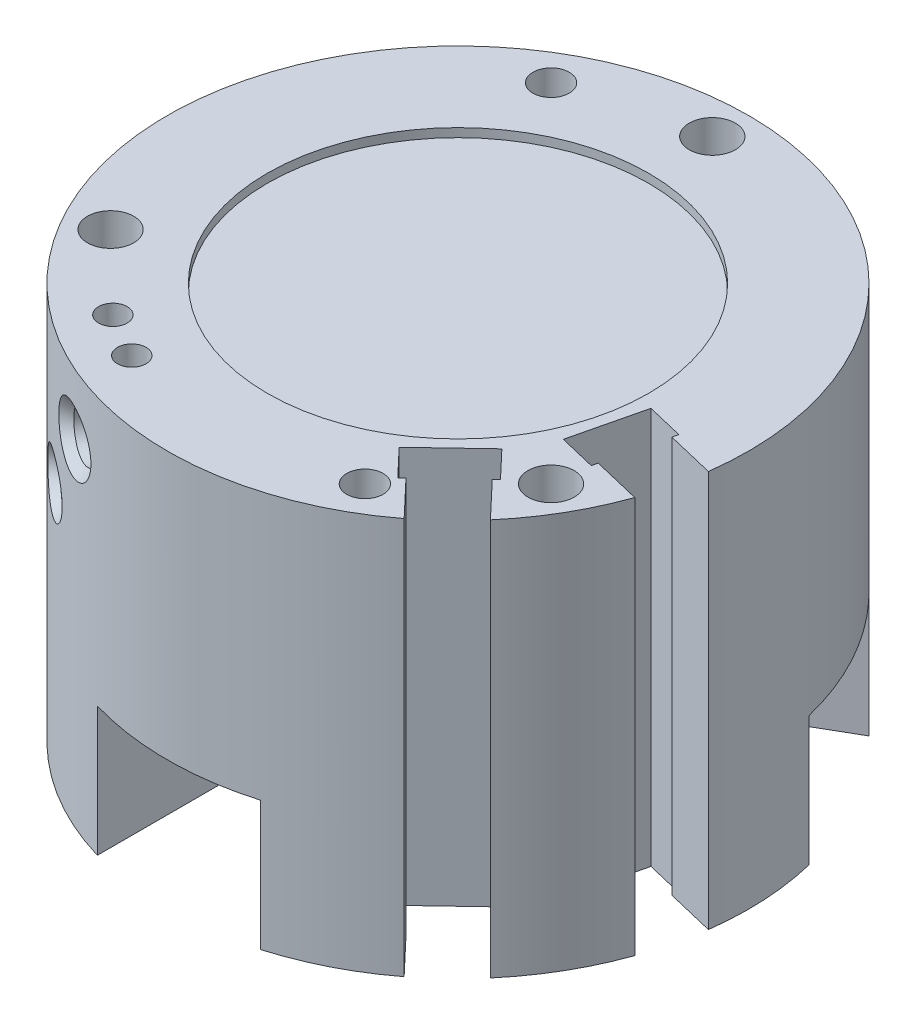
SolidWorks part; units mm, degrees
ref_plane "Front/Back" through (0, 0, 0) normal (0, 0, 1) x (1, 0, 0)
ref_plane "Top/Bottom" through (0, 0, 0) normal (0, 1, 0) x (1, 0, 0)
ref_plane "Right/Left" through (0, 0, 0) normal (1, 0, 0) x (0, 0, -1)
sketch "Sketch1" plane through (0, 0, 0) normal (0, 1, 0) x (1, 0, 0)
  circle A0 centre (0, 0) radius 25.4
  dimension "D1" = 50.8
extrude "Extrude1" add sketch "Sketch1" along normal mid plane 34.671
hole_wizard "#10-32 Tapped Hole1" positions "Sketch3" profile "Sketch2" tap size "#10-32" standard "Ansi Inch"
sketch "Sketch3" plane through (0, 17.3355, 0) normal (0, 1, 0) x (-1, 0, 0)
  line L0 (0, 0) -> (0, -27.1064) construction
  circle A0 centre (0, 0) radius 22.225 construction
  point P0 (0, -22.225)
  dimension "D1" = 44.45
sketch "Sketch2" plane through (0, 17.3355, -22.225) normal (1, 0, 0) x (0, 0, 1)
  line L0 (0, 0) -> (0, 14.8277)
  line L1 (0, 14.8277) -> (2.0193, 13.6144)
  line L2 (2.0193, 13.6144) -> (2.0193, 0)
  line L5 (2.0193, 0) -> (0, 0)
  line L10 (0, 14.8277) -> (-2.0193, 13.6144) construction
  line L11 (0, -6.35) -> (0, 107.95) construction
  dimension "Tap Drill Dia." = 4.0386
  dimension "Tap Drill Depth" = 13.6144
  dimension "Drill Angle" = 118
pattern_circular "CirPattern1" count 3 over 360 about axis through (0, 0, 0) along (0, 1, 0) of "#10-32 Tapped Hole1"
sketch "Sketch4" plane through (0, 17.3355, 0) normal (0, 1, 0) x (-1, 0, 0)
  line L0 (0, 0) -> (0, -26.9204) construction
  line L1 (0, 0) -> (16.0935, -27.8748) construction
  circle A0 centre (11.1125, -19.2474) radius 1.5875
  circle A1 centre (0, 0) radius 22.225 construction
  dimension "D2" = 3.175
  dimension "D3" = 44.45
  dimension "D1" = 30
extrude "Cut-Extrude1" cut sketch "Sketch4" against normal blind 3.175
pattern_circular "CirPattern2" count 2 over 360 about axis through (0, 17.3355, 0) along (0, -1, 0) of "Cut-Extrude1"
hole_wizard "M3x0.5 Tapped Hole1" positions "Sketch6" profile "Sketch5" tap size "M3x0.5" standard "Ansi Metric"
sketch "Sketch6" plane through (0, 17.3355, 0) normal (0, 1, 0) x (-1, 0, 0)
  line L0 (0, 0) -> (0, 27.0134) construction
  line L1 (0, 0) -> (11.3675, 25.5318) construction
  line L2 (0, 0) -> (17.8681, 24.5933) construction
  circle A0 centre (0, 0) radius 21.59 construction
  point P0 (8.7814, 19.7234)
  point P8 (12.6903, 17.4667)
  dimension "D1" = 43.18
  dimension "D2" = 24
  dimension "D3" = 12
sketch "Sketch5" plane through (-8.7814, 17.3355, 19.7234) normal (1, 0, 0) x (0, 0, 1)
  line L0 (0, 0) -> (0, 22.3012)
  line L1 (0, 22.3012) -> (1.25, 21.5501)
  line L2 (1.25, 21.5501) -> (1.25, 0)
  line L5 (1.25, 0) -> (0, 0)
  line L10 (0, 22.3012) -> (-1.25, 21.5501) construction
  line L11 (0, -6.35) -> (0, 107.95) construction
  dimension "Tap Drill Dia." = 2.5
  dimension "Tap Drill Depth" = 21.5501
  dimension "Drill Angle" = 118
sketch "Sketch7" plane through (0, 17.3355, 0) normal (0, 1, 0) x (-1, 0, 0)
  circle A0 centre (0, 0) radius 16.6624
  dimension "D1" = 33.3248
extrude "Cut-Extrude2" cut sketch "Sketch7" against normal blind 0.762
ref_plane "Plane4" through (0, 0, 0) normal (-0.5, 0, 0.866) x (0.866, 0, 0.5)
ref_plane "Plane5" through (-12.7, 0, 21.997) normal (-0.5, 0, 0.866) x (0.866, 0, 0.5)
hole_wizard "#10-32 Tapped Hole4" positions "Sketch13" profile "Sketch12" tap size "#10-32" standard "ANSI Inch"
sketch "Sketch13" plane through (-12.7, 0, 21.997) normal (-0.5, 0, 0.866) x (0.866, 0, 0.5)
  line L0 (25.4, 17.3355) -> (-25.4, 17.3355) construction
  line L1 (16.6624, 17.3355) -> (-16.6624, 17.3355) construction
  line L2 (0, 0) -> (0, 22.8777) construction
  line L3 (0, 17.3355) -> (0, -17.3355) construction
  line L4 (2.2568, -4.2146) -> (2.2568, 17.3355) construction
  line L5 (-2.2568, -4.2146) -> (-2.2568, 17.3355) construction
  point P0 (2.2568, 11.7475)
  point P1 (-2.2568, 5.2705)
  dimension "D1" = 5.588
  dimension "D2" = 12.065
sketch "Sketch12" plane through (-10.7456, 11.7475, 23.1254) normal (0, 1, 0) x (0.866, 0, 0.5)
  line L0 (0, 0) -> (0, 9.2397)
  line L1 (0, 9.2397) -> (2.0193, 8.0264)
  line L2 (2.0193, 8.0264) -> (2.0193, 0)
  line L5 (2.0193, 0) -> (0, 0)
  line L10 (0, 9.2397) -> (-2.0193, 8.0264) construction
  line L11 (0, -6.35) -> (0, 107.95) construction
  dimension "Tap Drill Dia." = 4.0386
  dimension "Tap Drill Depth" = 8.0264
  dimension "Drill Angle" = 118
chamfer "Chamfer1" distance 0.762 angle 45 2 edges at (-12.449, 12.2002, 22.1401) (-16.1804, 5.7309, 19.5795)
sketch "Sketch14" plane through (0, 17.3355, 0) normal (0, 1, 0) x (-1, 0, 0)
  line L0 (11.1125, -19.2474) -> (-11.1125, 19.2474) construction
  line L1 (0, 0) -> (-20.4632, 21.5637) construction
  line L2 (-15.453, 20.1585) -> (-12.4807, 17.0263)
  line L3 (-16.3498, 13.3547) -> (-19.3221, 16.4868)
  line L4 (-12.4807, 17.0263) -> (-12.1122, 17.376)
  line L5 (-9.8392, 14.9808) -> (-14.4454, 10.6098)
  line L6 (-14.4454, 10.6098) -> (-16.7183, 13.005)
  line L7 (-16.7183, 13.005) -> (-16.3498, 13.3547)
  line L8 (-12.1122, 17.376) -> (-9.8392, 14.9808)
  circle A1 centre (0, 0) radius 25.4
  arc A2 (-15.453, 20.1585) -> (-19.3221, 16.4868) centre (0, 0) ccw
  dimension "D1" = 13.5
  dimension "D3" = 5.334
  dimension "D4" = 3.302
  dimension "D5" = 6.35
  dimension "D6" = 7.62
  dimension "D2" = 0
extrude "Cut-Extrude3" cut sketch "Sketch14" against normal through all
pattern_circular "CirPattern3" count 2 every 33 about axis through (0, 17.3355, 0) along (0, -1, 0) of "Cut-Extrude3"
sketch "Sketch16" plane through (0, -17.3355, 0) normal (0, -1, 0) x (1, 0, 0)
  line L0 (0, 0) -> (27.0134, 0) construction
  line L1 (0, -8.2416) -> (-17.542, -18.3695)
  line L2 (0, 0) -> (25.6734, -14.8225) construction
  line L3 (7.1374, 4.1208) -> (24.6794, -6.0071)
  line L4 (0, -8.2416) -> (17.542, -18.3695)
  line L5 (0, 0) -> (-27.6793, -15.9806) construction
  line L6 (0, 0) -> (0, 36.1149) construction
  line L7 (-7.1374, 4.1208) -> (-24.6794, -6.0071)
  line L8 (-7.1374, 4.1208) -> (-7.1374, 24.3766)
  line L9 (7.1374, 4.1208) -> (7.1374, 24.3766)
  line L24 (25.1843, 3.3034) -> (20.9856, 2.2954)
  line L25 (20.9856, 2.2954) -> (21.1042, 1.8014)
  line L26 (21.1042, 1.8014) -> (17.8934, 1.0306)
  line L27 (17.8934, 1.0306) -> (16.411, 7.2052)
  line L28 (16.411, 7.2052) -> (19.6218, 7.976)
  line L29 (19.6218, 7.976) -> (19.7404, 7.482)
  line L30 (19.7404, 7.482) -> (23.9391, 8.49)
  line L31 (19.3221, 16.4868) -> (16.3498, 13.3547)
  line L32 (16.3498, 13.3547) -> (16.7183, 13.005)
  line L33 (16.7183, 13.005) -> (14.4454, 10.6098)
  line L34 (14.4454, 10.6098) -> (9.8392, 14.9808)
  line L35 (9.8392, 14.9808) -> (12.1122, 17.376)
  line L36 (12.1122, 17.376) -> (12.4807, 17.0263)
  line L37 (12.4807, 17.0263) -> (15.453, 20.1585)
  arc A0 (17.542, -18.3695) -> (24.6794, -6.0071) centre (0, 0) ccw
  arc A1 (-24.6794, -6.0071) -> (-17.542, -18.3695) centre (0, 0) ccw
  arc A2 (15.453, 20.1585) -> (25.1843, 3.3034) centre (0, 0) ccw
  arc A3 (23.9391, 8.49) -> (19.3221, 16.4868) centre (0, 0) ccw
  arc A4 (7.1374, 24.3766) -> (-7.1374, 24.3766) centre (0, 0) ccw
  dimension "D1" = 30
  dimension "D2" = 14.2748
  dimension "D3" = 120
  dimension "D4" = 120
  dimension "D5" = 14.2748
  dimension "D6" = 14.2748
  dimension "D7" = 0
extrude "Cut-Extrude4" cut sketch "Sketch16" against normal blind 11.303
